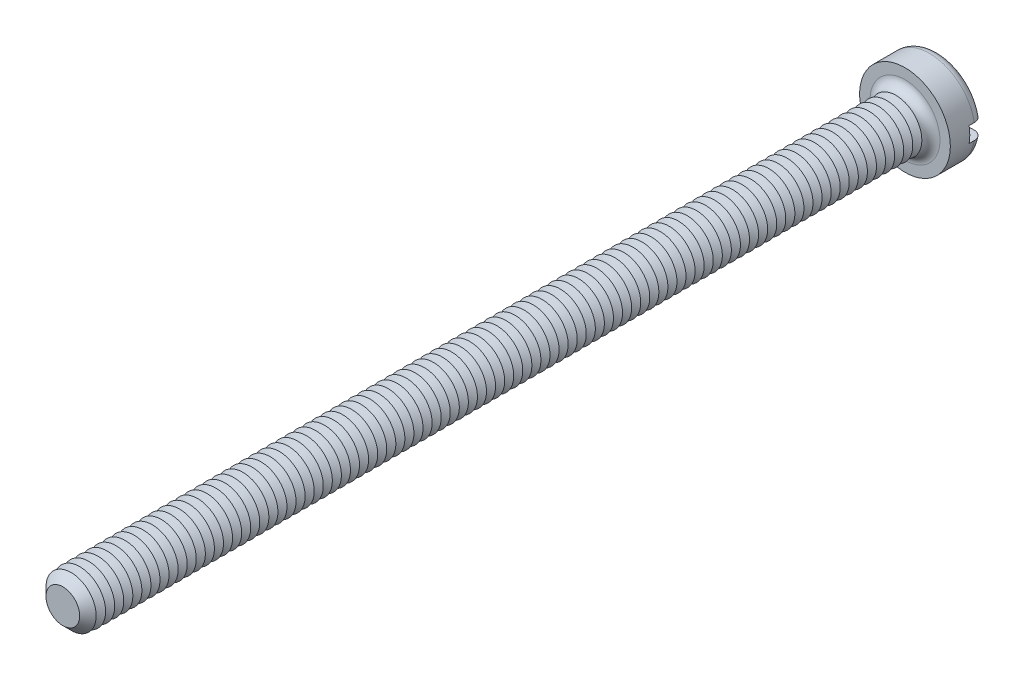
SolidWorks part; units mm, degrees
ref_plane "Front Plane" through (0, 0, 0) normal (0, 0, 1) x (1, 0, 0)
ref_plane "Top Plane" through (0, 0, 0) normal (0, 1, 0) x (1, 0, 0)
ref_plane "Right Plane" through (0, 0, 0) normal (1, 0, 0) x (0, 0, -1)
sketch "Sketch3" plane through (0, 0, 0) normal (0, 0, 1) x (1, 0, 0)
  circle A0 centre (0, 0) radius 3.5
  dimension "D1" = 7
extrude "Boss-Extrude2" add sketch "Sketch3" against normal blind 2.6
sketch "Sketch4" plane through (0, 0, 0) normal (0, 0, 1) x (1, 0, 0)
  circle A0 centre (0, 0) radius 2
  dimension "D1" = 4
extrude "Boss-Extrude3" add sketch "Sketch4" along normal blind 65
fillet "Fillet1" radius 0.7 2 edges at (3.5, 0, -2.6) (2, 0, 0)
chamfer "Chamfer1" distance 0.7 angle 45 1 edges at (2, 0, 65)
sketch "Sketch5" plane through (0, 0, 0) normal (1, 0, 0) x (0, 0, -1)
  line L0 (1.6944, 0) -> (-7.6738, 0) construction
sketch "Sketch6" plane through (0, 0, 0) normal (1, 0, 0) x (0, 0, -1)
  line L0 (-0.7, 2) -> (-1.05, 1.3938)
  line L1 (-1.05, 1.3938) -> (-1.4, 2)
  line L2 (-0.7, 2) -> (-64.3, 2) construction
  line L3 (-1.4, 2) -> (-0.7, 2)
  dimension "D1" = 0.7
revolve "Cut-Revolve1" cut sketch "Sketch6" angle 360 about L0
pattern_linear "LPattern1" count 91 spacing 0.7 along (0, 0, 1) of "Cut-Revolve1"
sketch "Sketch8" plane through (0, 0, -2.6) normal (0, 0, -1) x (-1, 0, 0)
  line L1 (3.5, -0.6) -> (-3.5, -0.6)
  line L2 (3.5, -0.6) -> (3.5, 0.6)
  line L3 (3.5, 0.6) -> (-3.5, 0.6)
  line L4 (-3.5, -0.6) -> (-3.5, 0.6)
  line L5 (3.5, -0.6) -> (-3.5, 0.6) construction
  line L6 (3.5, 0.6) -> (-3.5, -0.6) construction
  point P0 (0, 0)
  dimension "D1" = 7
  dimension "D2" = 1.2
extrude "Cut-Extrude1" cut sketch "Sketch8" against normal blind 1.1
